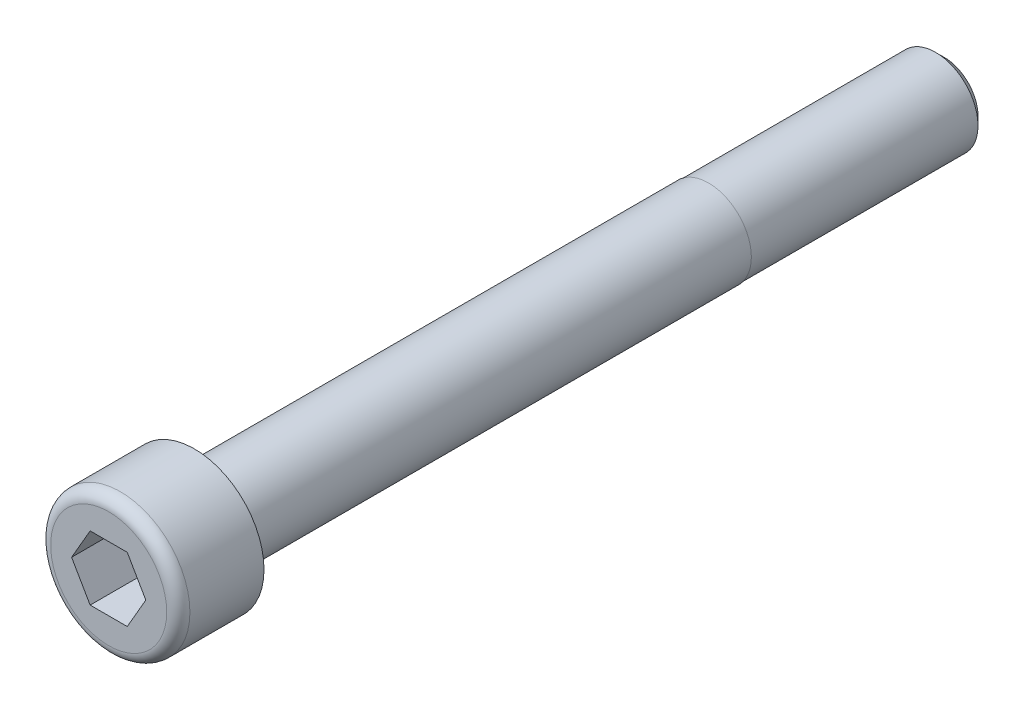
SolidWorks part; units mm, degrees
extrude "Base-Extrusion" add sketch "Esquisse1" along normal blind 8
sketch "Esquisse1" plane through (0, 0, 0) normal (0, 0, 1) x (1, 0, 0)
  circle A0 centre (0, 0) radius 6.5
  dimension "D1" = 13
ref_plane "Plane1" through (0, 0, 0) normal (0, 0, 1) x (1, 0, 0)
ref_plane "Plane2" through (0, 0, 0) normal (0, 1, 0) x (1, 0, 0)
ref_plane "Plane3" through (0, 0, 0) normal (1, 0, 0) x (0, 0, -1)
sketch "Esquisse2" plane through (0, 0, 0) normal (0, 0, -1) x (-1, 0, 0)
  circle A0 centre (0, 0) radius 4
  circle A1 centre (0, 0) radius 6.5 construction
extrude "Boss.-Extru.1" add sketch "Esquisse2" along normal blind 48
sketch "Esquisse3" plane through (0, 0, 8) normal (0, 0, 1) x (1, 0, 0)
  line L0 (0, 0) -> (0, 4.2257) construction
  line L1 (0, 0) -> (4.4294, 0) construction
  line L2 (3.4641, 0) -> (1.7321, 3)
  line L3 (1.7321, 3) -> (-1.7321, 3)
  line L4 (-1.7321, 3) -> (-3.4641, 0)
  line L5 (-3.4641, 0) -> (-1.7321, -3)
  line L6 (-1.7321, -3) -> (1.7321, -3)
  line L7 (1.7321, -3) -> (3.4641, 0)
  dimension "D1" = 6
  dimension "D3" = 120
extrude "Enlèv. mat.-Extru.1" cut sketch "Esquisse3" against normal blind 8
sketch "Esquisse6" plane through (0, 0, -48) normal (0, 0, -1) x (-1, 0, 0)
  circle A0 centre (0, 0) radius 3.95
extrude "Boss.-Extru.3" add sketch "Esquisse6" along normal blind 22
chamfer "Chanfrein3" distance 0.79 angle 45 1 edges at (-3.95, 0, -70)
fillet "Congé1" radius 1.0833 1 edges at (6.5, 0, 8)
equation "\"D1@Esquisse6\" = \"D1@Esquisse2\"-0.1"
equation "\"D1@Chanfrein3\" = \"D1@Esquisse6\"/10"
equation "\"D1@Congé1\" = \"D1@Esquisse1\"/12"
